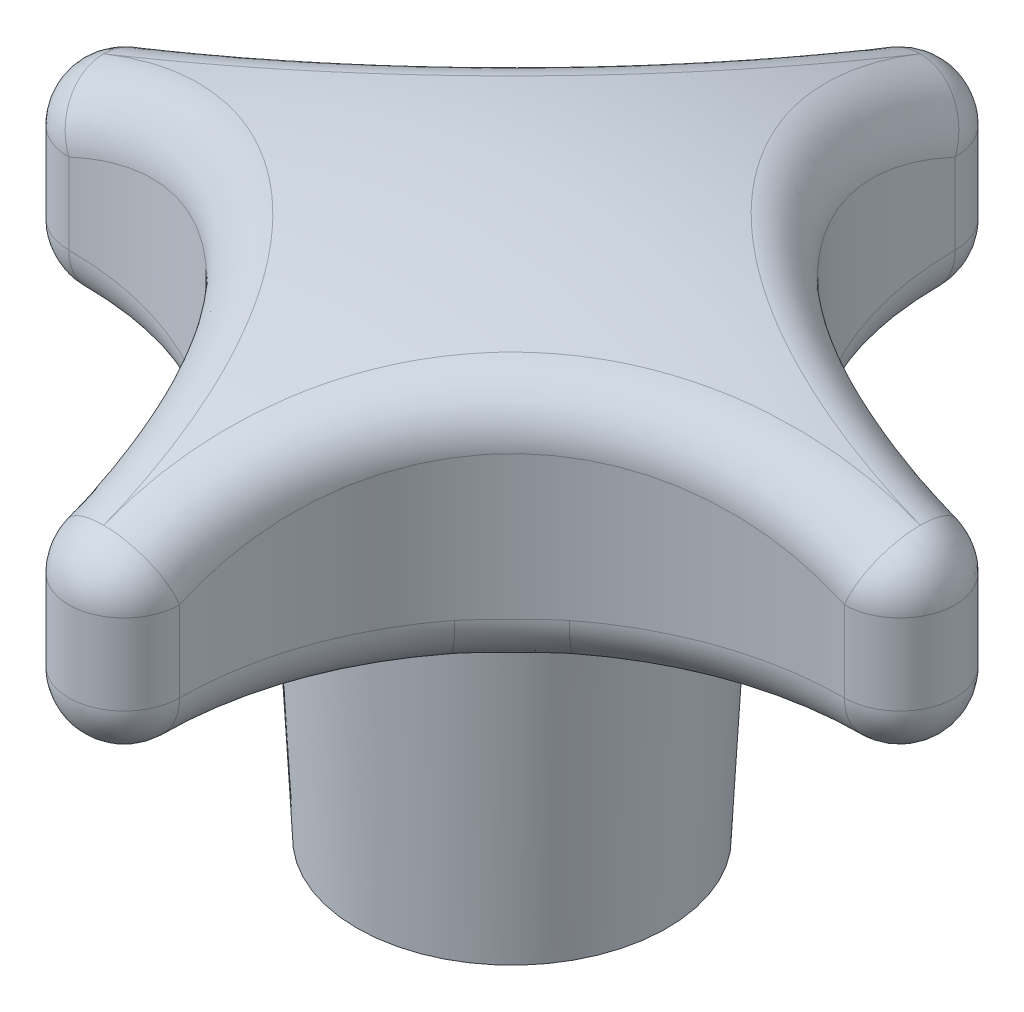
SolidWorks part; units mm, degrees
ref_plane "Front Plane" through (0, 0, 0) normal (0, 0, 1) x (1, 0, 0)
ref_plane "Top Plane" through (0, 0, 0) normal (0, 1, 0) x (1, 0, 0)
ref_plane "Right Plane" through (0, 0, 0) normal (1, 0, 0) x (0, 0, -1)
sketch "Sketch1" plane through (0, 0, 0) normal (0, 1, 0) x (1, 0, 0)
  circle A0 centre (0, 0) radius 7
  dimension "D1" = 14
extrude "Extrude1" add sketch "Sketch1" against normal blind 13
draft "Draft1" type of draft neutral plane draft angle 3 faces to draft 1 parameters "D1"=3
sketch "Sketch2" plane through (0, 0, 0) normal (0, 0, 1) x (1, 0, 0)
  line L0 (0, 0) -> (-20, 0)
  line L1 (-20, 0) -> (-20, 7.8)
  line L2 (0, 0) -> (0, 50000) construction
  line L3 (0, 12) -> (20.2547, 12) construction
  line L4 (0, 0) -> (0, 12)
  arc A0 (0, 12) -> (-20, 7.8) centre (0, -37.719) ccw
revolve "Revolve1" add sketch "Sketch2" angle 360 about L2
sketch "Sketch4" plane through (0, 0, 0) normal (0, 1, 0) x (1, 0, 0)
  line L0 (0, 0) -> (-50000, 0) construction
  line L1 (0, 0) -> (0, 50000) construction
  line L2 (-17.5, 2.5) -> (-45.9117, 2.5) construction
  line L3 (-2.5, 17.5) -> (-2.5, 40.3224) construction
  arc A0 (0, 20) -> (-2.5, 17.5) centre (0, 17.5) ccw
  arc A1 (-17.5, 2.5) -> (-20, 0) centre (-17.5, 0) ccw
  circle A2 centre (0, 0) radius 20 construction
  arc A3 (-17.5, 2.5) -> (-2.5, 17.5) centre (-17.5, 17.5) ccw
  arc A4 (0, 20) -> (-20, 0) centre (-20, 20) ccw
  point P9 (0, 20)
  point P10 (-20, 0)
  point P13 (-2.5, 17.5)
  point P14 (-17.5, 2.5)
extrude "Extrude3" cut sketch "Sketch4" along normal through all
pattern_circular "CirPattern1" count 4 over 360 about axis through (0, 0, 0) along (0, 1, 0) of "Extrude3"
fillet "Fillet2" radius 2.5 16 edges at (0, 0, 20) (6.8934, 0, 6.8934) (20, 0, 0) (6.8934, 0, -6.8934) (0, 0, -20) (-6.8934, 0, -6.8934) (-20, 0, 0) (-0.0002, 7.8, 20) (8.5156, 10.9569, 5.4883) (20, 7.8, 0.0002) (5.4883, 10.9569, -8.5156) (0.0002, 7.8, -20) (-8.5156, 10.9569, -5.4883) (-20, 7.8, 0.0002) (-6.8934, 0, 6.8934) (-5.4883, 10.9569, 8.5156)
sketch "Sketch6" plane through (0, -13, 0) normal (0, -1, 0) x (1, 0, 0)
  circle A0 centre (0, 0) radius 4
  dimension "D1" = 8
extrude "Extrude5" [suppressed] cut sketch "Sketch6" against normal blind 18
sketch "Sketch7" [suppressed] plane through (0, 0, 0) normal (0, 0, 1) x (1, 0, 0)
  line L0 (0, 4) -> (8, 4)
  line L1 (8, -28) -> (8, 4) construction
  line L2 (8, 4) -> (0, 8.6188)
  line L3 (0, 8.6188) -> (0, 4)
  line L4 (-8, -28) -> (8, -28) construction
revolve "Cut-Revolve1" [suppressed] cut sketch "Sketch7" angle 360 about L3
sketch "Sketch10" plane through (0, -13, 0) normal (0, -1, 0) x (1, 0, 0)
  circle A0 centre (0, 0) radius 3.4
  dimension "D1" = 6.8
extrude "Extrude8" cut sketch "Sketch10" against normal blind 18
sketch "Sketch11" plane through (0, 0, 0) normal (0, 0, 1) x (1, 0, 0)
  line L0 (0, 5) -> (3.4, 5)
  line L1 (-3.4, 5) -> (3.4, 5) construction
  line L2 (3.4, 5) -> (0, 6.963)
  line L3 (0, 6.963) -> (0, 5)
  dimension "D1" = 30
revolve "Cut-Revolve2" cut sketch "Sketch11" angle 360 about L3
equation "\"D2@Sketch2\" = \"D1@Sketch2\"*.65"
equation "\"D1@Sketch4\" = (\"D3@Sketch2\"*2)/8"
equation "\"D2@Sketch4\" =( \"D3@Sketch2\"*2)/8"
equation "\"D1@Sketch7\" = \"D1@Extrude5\""
